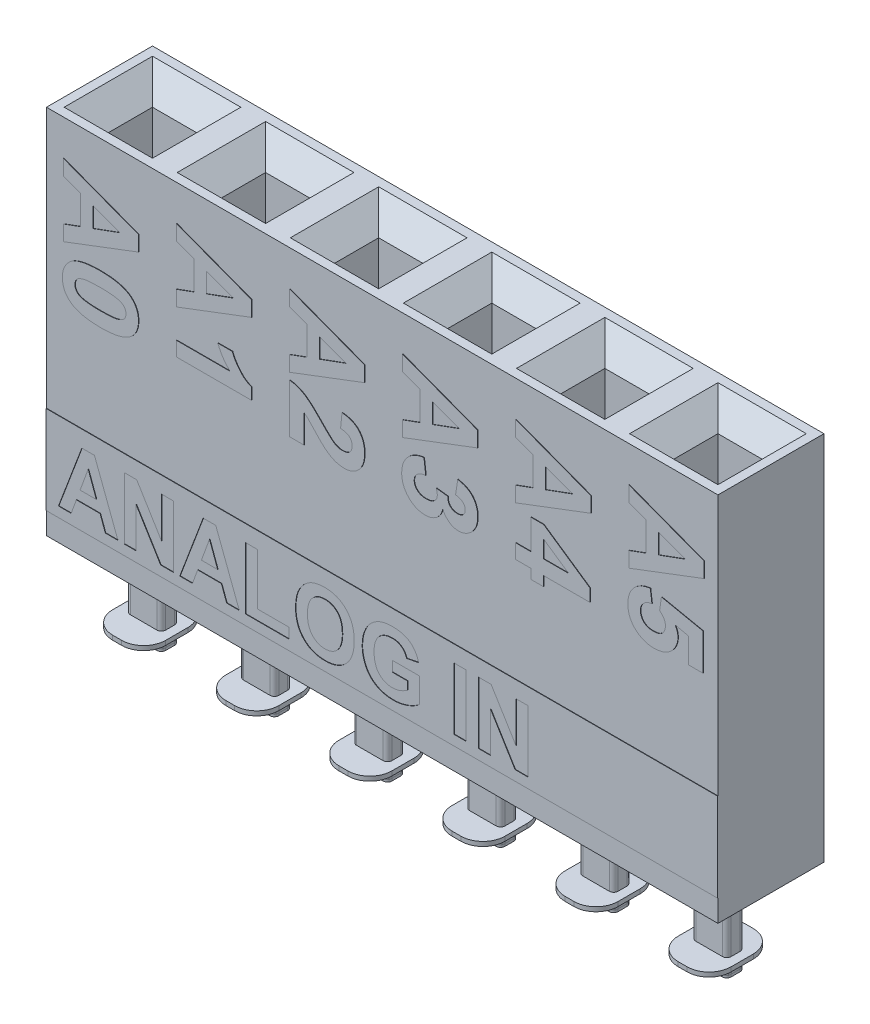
SolidWorks part; units mm, degrees
ref_plane "Plan de face" through (0, 0, 0) normal (0, 0, 1) x (1, 0, 0)
ref_plane "Plan de dessus" through (0, 0, 0) normal (0, 1, 0) x (1, 0, 0)
ref_plane "Plan de droite" through (0, 0, 0) normal (1, 0, 0) x (0, 0, -1)
sketch "Esquisse1" plane through (0, 0, 0) normal (0, 1, 0) x (1, 0, 0)
  line L1 (0, 0) -> (15.2, 0)
  line L2 (0, 0) -> (0, 2.4)
  line L3 (0, 2.4) -> (15.2, 2.4)
  line L4 (15.2, 0) -> (15.2, 2.4)
  dimension "D1" = 15.2
  dimension "D2" = 2.4
extrude "Boss.-Extru.1" add sketch "Esquisse1" along normal blind 8.4
sketch "Esquisse2" plane through (0, 8.4, 0) normal (0, 1, 0) x (1, 0, 0)
  line L0 (0, 0) -> (15.2, 0) construction
  line L1 (0.7, 0.7) -> (1.7, 0.7)
  line L2 (0.7, 0.7) -> (0.7, 1.7)
  line L3 (0.7, 1.7) -> (1.7, 1.7)
  line L4 (1.7, 0.7) -> (1.7, 1.7)
  line L5 (0, 2.4) -> (0, 0) construction
  dimension "D1" = 1
  dimension "D2" = 1
  dimension "D3" = 0.7
  dimension "D4" = 0.7
extrude "Enlèv. mat.-Extru.1" cut sketch "Esquisse2" against normal blind 2
chamfer "Chanfrein2" distance 0.5 angle 45 4 edges at (1.2, 8.4, -0.7) (1.7, 8.4, -1.2) (1.2, 8.4, -1.7) (0.7, 8.4, -1.2)
sketch "Esquisse3" plane through (0, 0, 0) normal (0, -1, 0) x (1, 0, 0)
  line L0 (15.2, -2.4) -> (0, -2.4) construction
  line L1 (0.8, -1) -> (1.6, -1)
  line L2 (0.8, -1) -> (0.8, -1.4)
  line L3 (0.8, -1.4) -> (1.6, -1.4)
  line L4 (1.6, -1) -> (1.6, -1.4)
  line L9 (0, -2.4) -> (0, 0) construction
  dimension "D1" = 0.4
  dimension "D2" = 0.8
  dimension "D7" = 0.8
  dimension "D8" = 1
extrude "Boss.-Extru.2" add sketch "Esquisse3" along normal blind 1.6
sketch "Esquisse5" plane through (0, -1.6, 0) normal (0, -1, 0) x (1, 0, 0)
  line L0 (0, -2.4) -> (0, 0) construction
  line L1 (1.1, -0.4) -> (1.3, -0.4)
  line L2 (0.6, -0.9) -> (0.6, -1.4)
  line L3 (1.1, -1.9) -> (1.3, -1.9)
  line L4 (1.8, -0.9) -> (1.8, -1.4)
  line L5 (15.2, -2.4) -> (0, -2.4) construction
  arc A0 (0.6, -1.4) -> (1.1, -1.9) centre (1.1, -1.4) ccw
  arc A1 (1.3, -1.9) -> (1.8, -1.4) centre (1.3, -1.4) ccw
  arc A2 (1.8, -0.9) -> (1.3, -0.4) centre (1.3, -0.9) ccw
  arc A3 (0.6, -0.9) -> (1.1, -0.4) centre (1.1, -0.9) cw
  point P10 (0.6, -1.9)
  point P15 (1.8, -0.4)
  point P18 (0.6, -0.4)
  dimension "D5" = 0.5
  dimension "D1" = 1.2
  dimension "D2" = 1.5
  dimension "D3" = 0.6
  dimension "D4" = 0.5
extrude "Boss.-Extru.3" add sketch "Esquisse5" along normal blind 0.1
sketch "Esquisse6" plane through (0, -1.7, 0) normal (0, -1, 0) x (1, 0, 0)
  line L1 (0.8, -1) -> (1.6, -1)
  line L2 (0.8, -1) -> (0.8, -1.4)
  line L3 (0.8, -1.4) -> (1.6, -1.4)
  line L4 (1.6, -1) -> (1.6, -1.4)
extrude "Boss.-Extru.4" add sketch "Esquisse6" along normal blind 0.3
fillet "Congé19" radius 0.1 4 edges at (0.8, -1.85, -1) (0.8, -1.85, -1.4) (1.6, -1.85, -1) (1.6, -1.85, -1.4)
fillet "Congé20" radius 0.1 4 edges at (0.8, -0.8, -1) (1.6, -0.8, -1) (1.6, -0.8, -1.4) (0.8, -0.8, -1.4)
fillet "Congé22" radius 0.25 7 edges at (1.5707, -1.7, -1.0293) (1.2, -1.7, -1) (0.8293, -1.7, -1.0293) (0.8, -1.7, -1.2) (1.5707, -1.7, -1.3707) (1.2, -1.7, -1.4) (0.8293, -1.7, -1.3707)
pattern_linear "Répétition linéaire1" count 6 spacing 2.56 along (1, 0, 0) of "Enlèv. mat.-Extru.1", "Chanfrein2"
pattern_linear "Répétition linéaire2" count 6 spacing 2.56 of "Boss.-Extru.2", "Boss.-Extru.3", "Boss.-Extru.4", "Congé20", "Congé19", "Congé22"
sketch "Esquisse7" plane through (0, 0, 0) normal (0, 0, 1) x (1, 0, 0)
  line L0 (0, 8.4) -> (0, 0) construction
  line L1 (0, 0.5) -> (15.2, 0.5)
  line L2 (0, 0.5) -> (0, 2.5)
  line L3 (0, 2.5) -> (15.2, 2.5)
  line L4 (15.2, 0.5) -> (15.2, 2.5)
  line L5 (15.2, 8.4) -> (15.2, 0) construction
  line L6 (0, 0) -> (15.2, 0) construction
  line L7 (13.1926, 7.6) -> (13.1926, 2.7766) construction
  line L8 (10.6326, 7.6) -> (10.6326, 2.7766) construction
  line L9 (8.0726, 7.6) -> (8.0726, 2.7766) construction
  line L10 (5.5126, 7.6) -> (5.5126, 2.7766) construction
  line L11 (2.9526, 7.6) -> (2.9526, 2.7766) construction
  line L12 (0.3926, 7.6) -> (0.3926, 2.7766) construction
  line L13 (0, 8.4) -> (15.2, 8.4) construction
  text T0 "A0" font "Arial" height 1.7
  text T1 "A1" font "Arial" height 1.7
  text T2 "A2" font "Arial" height 1.7
  text T3 "A3" font "Arial" height 1.7
  text T4 "A4" font "Arial" height 1.7
  text T5 "A5" font "Arial" height 1.7
  dimension "D1" = 0.5
  dimension "D2" = 2
  dimension "D3" = 0.8
  dimension "D4" = 2.56
  dimension "D5" = 2.56
  dimension "D6" = 2.56
  dimension "D7" = 2.56
  dimension "D8" = 2.56
extrude "Boss.-Extru.5" add sketch "Esquisse7" along normal blind 0.01
sketch "Esquisse8" plane through (0, 0, 0.01) normal (0, 0, 1) x (1, 0, 0)
  line L0 (0.2819, 0.7281) -> (14.7764, 0.7281) construction
  text T0 "ANALOG IN" font "Arial" height 1.4
extrude "Enlèv. mat.-Extru.2" cut sketch "Esquisse8" against normal blind 0.01
